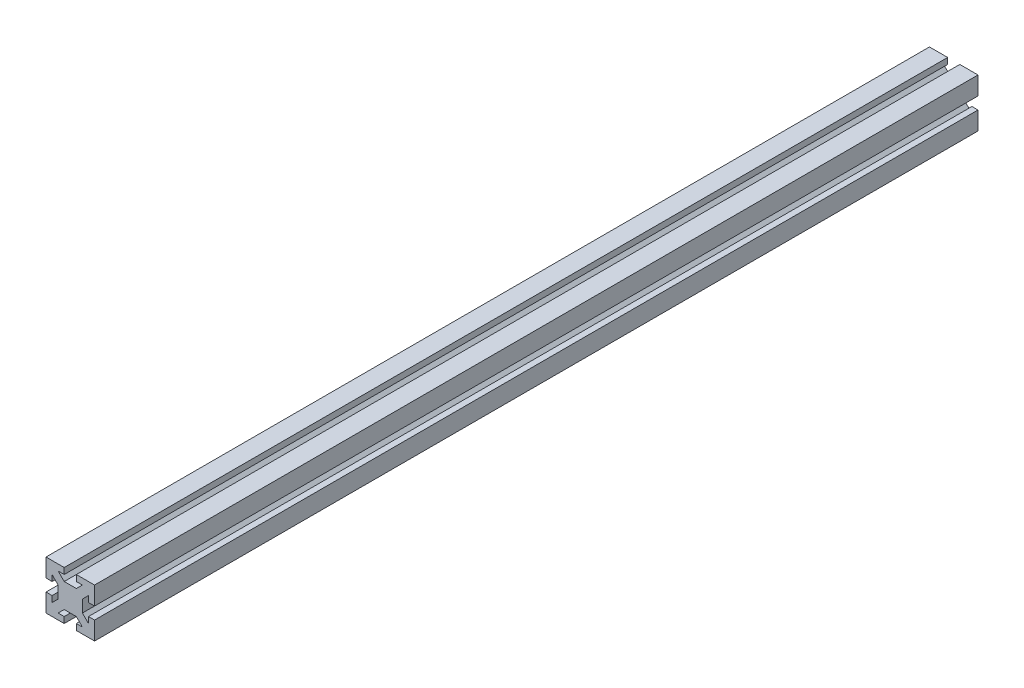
SolidWorks part; units mm, degrees
ref_plane "Front Plane" through (0, 0, 0) normal (0, 0, 1) x (1, 0, 0)
ref_plane "Top Plane" through (0, 0, 0) normal (0, 1, 0) x (1, 0, 0)
ref_plane "Right Plane" through (0, 0, 0) normal (1, 0, 0) x (0, 0, -1)
sketch "Sketch1" plane through (0, 0, 0) normal (0, 0, 1) x (1, 0, 0)
  line L0 (-5, 20) -> (-5, 15)
  line L1 (-20, -20) -> (-5, -20)
  line L2 (-20, -20) -> (-20, -5)
  line L3 (-20, 20) -> (-5, 20)
  line L4 (20, -20) -> (20, -5)
  line L5 (-20, -20) -> (20, 20) construction
  line L6 (-20, 20) -> (20, -20) construction
  line L7 (-5, 15) -> (-10, 15)
  line L8 (-10, 15) -> (-5, 10)
  line L9 (-5, 10) -> (5, 10)
  line L10 (5, 10) -> (10, 15)
  line L11 (10, 15) -> (5, 15)
  line L12 (5, 15) -> (5, 20)
  line L13 (5, 20) -> (20, 20)
  line L14 (20, 5) -> (15, 5)
  line L15 (15, 10) -> (10, 5)
  line L16 (10, 5) -> (10, -5)
  line L17 (15, 5) -> (15, 10)
  line L18 (15, -10) -> (15, -5)
  line L19 (15, -5) -> (20, -5)
  line L20 (10, -5) -> (15, -10)
  line L21 (5, -20) -> (5, -15)
  line L22 (10, -15) -> (5, -10)
  line L23 (5, -10) -> (-5, -10)
  line L24 (5, -15) -> (10, -15)
  line L25 (-10, -15) -> (-5, -15)
  line L26 (-5, -15) -> (-5, -20)
  line L27 (-5, -10) -> (-10, -15)
  line L28 (-20, -5) -> (-15, -5)
  line L29 (-15, -10) -> (-10, -5)
  line L30 (-10, -5) -> (-10, 5)
  line L31 (-15, -5) -> (-15, -10)
  line L32 (-15, 10) -> (-15, 5)
  line L33 (-15, 5) -> (-20, 5)
  line L34 (-10, 5) -> (-15, 10)
  line L35 (20, 5) -> (20, 20)
  line L36 (5, -20) -> (20, -20)
  line L37 (-20, 5) -> (-20, 20)
  point P0 (0, 0)
  point P8 (0, 10)
  point P42 (0, 0)
  dimension "D1" = 40
  dimension "D2" = 40
  dimension "D3" = 5
  dimension "D4" = 10
  dimension "D5" = 5
  dimension "D6" = 5
  dimension "D7" = 10
  dimension "D8" = 4
extrude "Boss-Extrude1" add sketch "Sketch1" along normal mid plane 728
